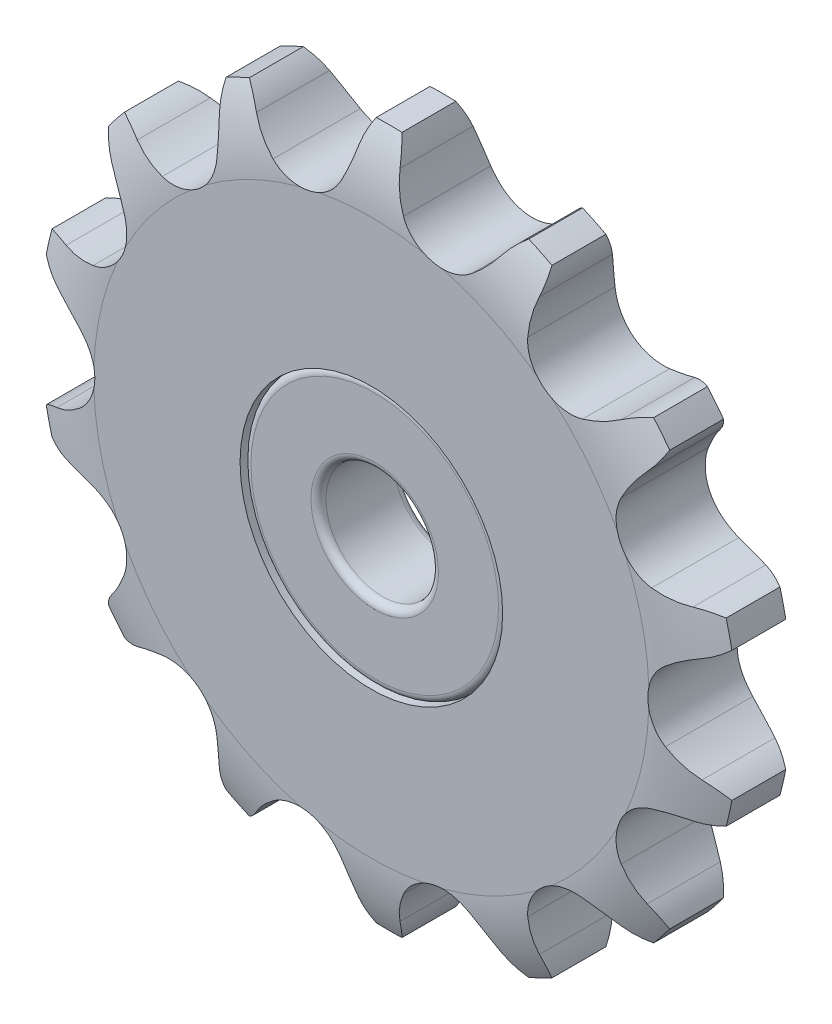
SolidWorks part; units mm, degrees
other "Imported1"
ref_plane "Front" through (0, 0, 0) normal (0, 0, 1) x (1, 0, 0)
ref_plane "Top" through (0, 0, 0) normal (0, 1, 0) x (1, 0, 0)
ref_plane "Right" through (0, 0, 0) normal (1, 0, 0) x (0, 0, -1)
imported_body "ｲﾝﾎﾟｰﾄ1"
sketch "ｽｹｯﾁ1" plane through (0, 0, 0) normal (0, 0, 1) x (1, 0, 0)
  circle A0 centre (0, 0) radius 54.8532
  circle A1 centre (0, 0) radius 46.5
extrude "ｶｯﾄ - 押し出し1" cut sketch "ｽｹｯﾁ1" against normal through all both and the other way through all
